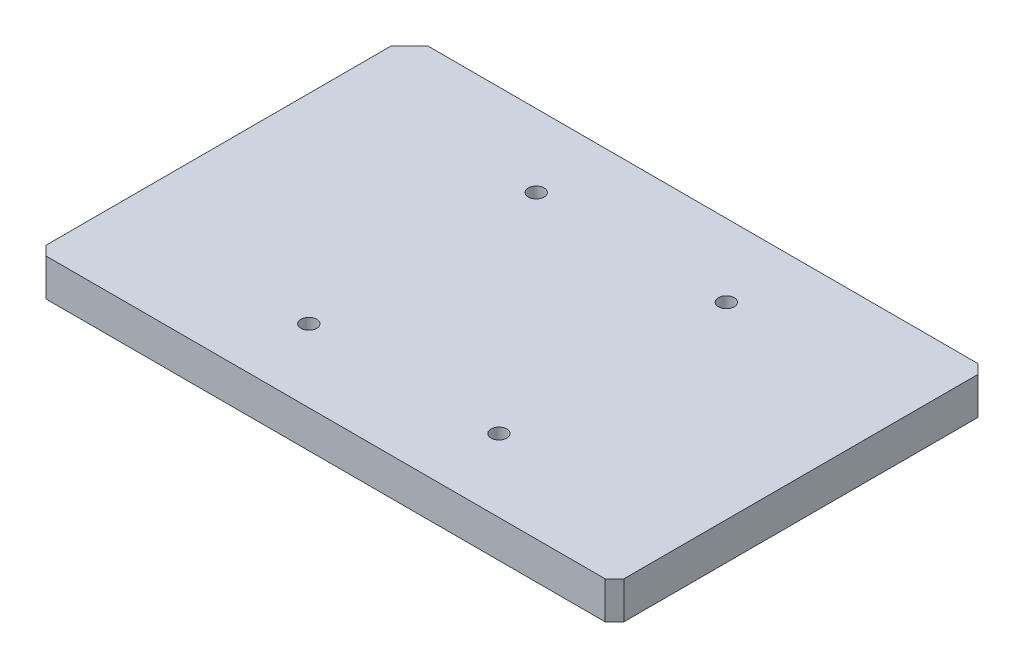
SolidWorks part; units mm, degrees
ref_plane "Front Plane" through (0, 0, 0) normal (0, 0, 1) x (1, 0, 0)
ref_plane "Top Plane" through (0, 0, 0) normal (0, 1, 0) x (1, 0, 0)
ref_plane "Right Plane" through (0, 0, 0) normal (1, 0, 0) x (0, 0, -1)
sketch "Sketch1" plane through (0, 0, 0) normal (0, 1, 0) x (1, 0, 0)
  line L0 (-155, -95) -> (-150, -100)
  line L1 (-150, -100) -> (150, -100)
  line L2 (-155, -95) -> (-155, 90)
  line L3 (-145, 100) -> (150, 100)
  line L4 (155, -95) -> (155, 95)
  line L5 (-155, -100) -> (155, 100) construction
  line L6 (-155, 100) -> (155, -100) construction
  line L7 (-155, 90) -> (-145, 100)
  line L8 (150, 100) -> (155, 95)
  line L9 (150, -100) -> (155, -95)
  point P0 (0, 0)
  dimension "D1" = 310
  dimension "D2" = 200
extrude "Boss-Extrude1" add sketch "Sketch1" along normal blind 20 contours L3 L8 L4 L9 L1 L0 L2 L7
sketch "Sketch2" plane through (0, 0, 0) normal (0, -1, 0) x (1, 0, 0)
  line L0 (-155, 95) -> (-155, -90) construction
  line L1 (-150, 100) -> (150, 100) construction
  circle A0 centre (-48, 61) radius 4.25
  circle A1 centre (-48, -61) radius 4.25
  circle A2 centre (54, -61) radius 4.25
  circle A3 centre (54, 61) radius 4.25
  point P3 (54, 61)
  dimension "D1" = 8.5
  dimension "D4" = 8.5
  dimension "D5" = 8.5
  dimension "D6" = 8.5
  dimension "D2" = 107
  dimension "D3" = 39
  dimension "D7" = 122
  dimension "D8" = 122
  dimension "D9" = 39
  dimension "D10" = 102
  dimension "D11" = 102
extrude "Cut-Extrude1" cut sketch "Sketch2" against normal up to next
sketch "Sketch3" plane through (0, 0, 0) normal (0, -1, 0) x (1, 0, 0)
  circle A0 centre (-48, 61) radius 7.5
  circle A1 centre (54, 61) radius 7.5
  circle A2 centre (54, -61) radius 7.5
  circle A3 centre (-48, -61) radius 7.5
  dimension "D1" = 15
  dimension "D2" = 15
  dimension "D3" = 15
  dimension "D4" = 15
extrude "Cut-Extrude2" cut sketch "Sketch3" against normal blind 10
